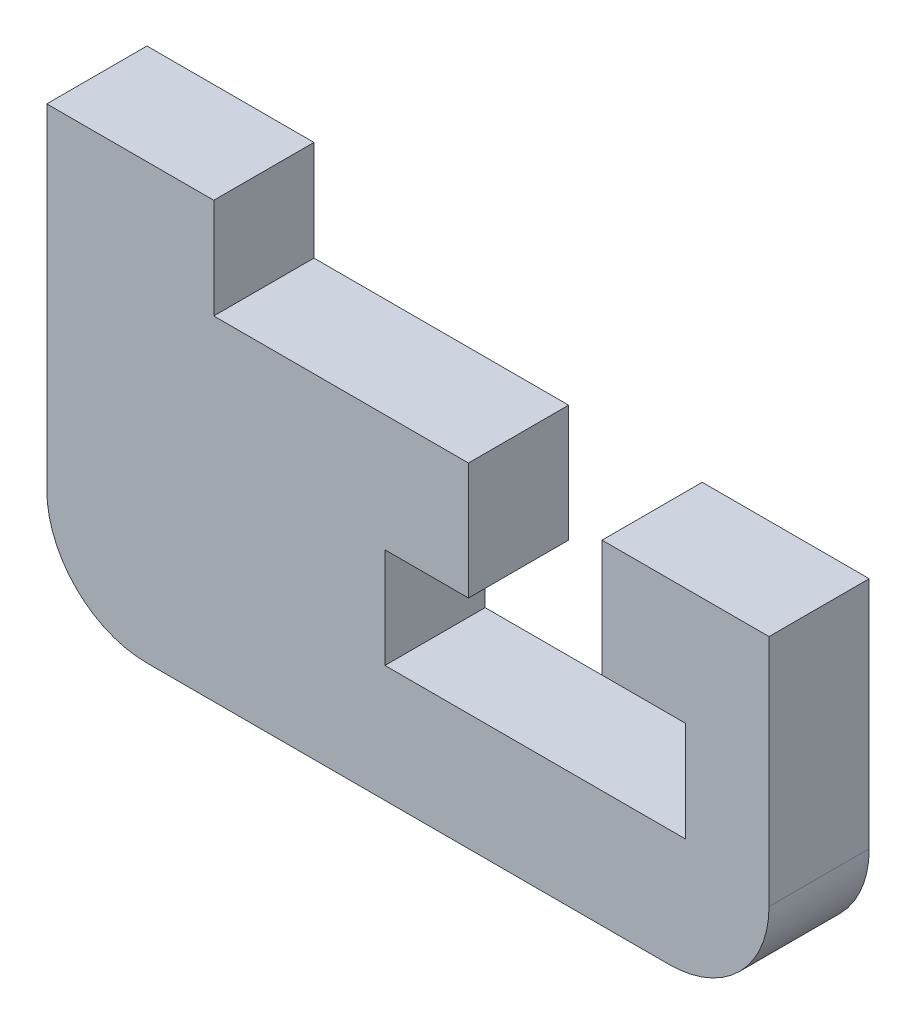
SolidWorks part; units mm, degrees
ref_plane "Alzado" through (0, 0, 0) normal (0, 0, 1) x (1, 0, 0)
ref_plane "Planta" through (0, 0, 0) normal (0, 1, 0) x (1, 0, 0)
ref_plane "Vista lateral" through (0, 0, 0) normal (1, 0, 0) x (0, 0, -1)
sketch "Croquis1" plane through (0, 0, 0) normal (0, 0, 1) x (1, 0, 0)
  line L0 (0, 22.001) -> (-5, 22.001)
  line L1 (-5, 22.001) -> (-5, 12.001)
  line L2 (11.625, 19.001) -> (16.625, 19.001)
  line L3 (16.625, 19.001) -> (16.625, 12.001)
  line L4 (11.625, 19.001) -> (11.625, 15.501)
  line L5 (11.625, 15.501) -> (14.125, 15.501)
  line L6 (14.125, 15.501) -> (14.125, 12.501)
  line L7 (14.125, 12.501) -> (5.125, 12.501)
  line L8 (5.125, 12.501) -> (5.125, 15.501)
  line L9 (5.125, 15.501) -> (7.625, 15.501)
  line L10 (7.625, 15.501) -> (7.625, 19.001)
  line L11 (7.625, 19.001) -> (0, 19.001)
  line L12 (0, 19.001) -> (0, 22.001)
  line L13 (13.625, 9.001) -> (-2, 9.001)
  arc A0 (-5, 12.001) -> (-2, 9.001) centre (-2, 12.001) ccw
  arc A1 (16.625, 12.001) -> (13.625, 9.001) centre (13.625, 12.001) cw
  dimension "D1" = 3
  dimension "D2" = 3
extrude "Saliente-Extruir1" add sketch "Croquis1" along normal blind 3
